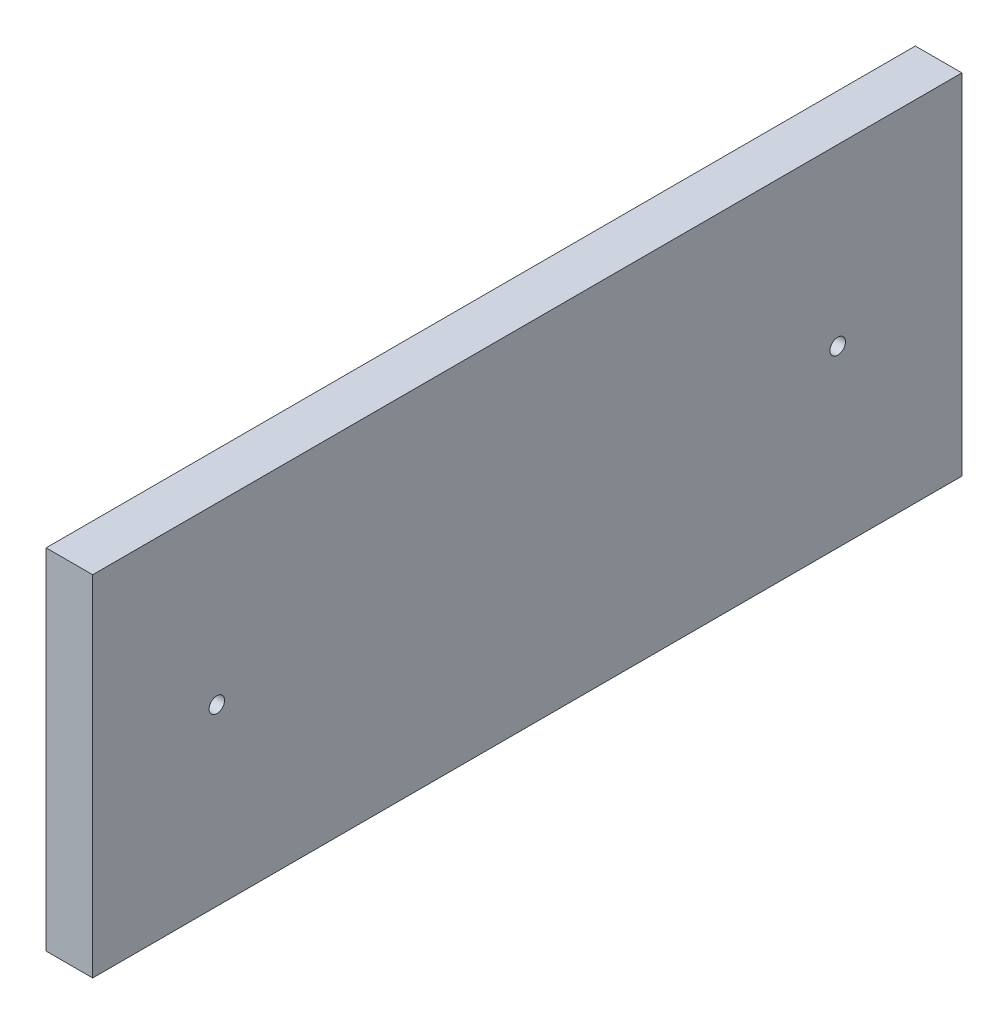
SolidWorks part; units mm, degrees
ref_plane "Front Plane" through (0, 0, 0) normal (0, 0, 1) x (1, 0, 0)
ref_plane "Top Plane" through (0, 0, 0) normal (0, 1, 0) x (1, 0, 0)
ref_plane "Right Plane" through (0, 0, 0) normal (1, 0, 0) x (0, 0, -1)
sketch "Sketch2" plane through (0, 0, 0) normal (0, 0, 1) x (1, 0, 0)
  line L1 (0, 0) -> (38.1, 0)
  line L2 (0, 0) -> (0, 285.75)
  line L3 (0, 285.75) -> (38.1, 285.75)
  line L4 (38.1, 0) -> (38.1, 285.75)
  line L5 (0, 0) -> (38.1, 285.75) construction
  line L6 (0, 285.75) -> (38.1, 0) construction
  point P4 (19.05, 142.875)
extrude "Boss-Extrude1" add sketch "Sketch2" along normal blind 711.2
sketch "Sketch3" plane through (38.1, 0, 0) normal (1, 0, 0) x (0, 0, -1)
  line L0 (-711.2, 142.875) -> (-609.6, 142.875) construction
  line L3 (-711.2, 0) -> (-711.2, 285.75) construction
  line L4 (-101.6, 142.875) -> (0, 142.875) construction
  line L5 (0, 0) -> (0, 285.75) construction
  circle A0 centre (-609.6, 142.875) radius 6.35
  circle A1 centre (-101.6, 142.875) radius 6.35
extrude "Cut-Extrude1" cut sketch "Sketch3" against normal through all
equation "\"system_width\"= 7ft + 10 "
equation "\"system_length\"= 95.5"
equation "\"module_board_length\"= 11.25in"
equation "\"module_board_width\"= 1.5in"
equation "\"module_width\"= (\"system_width\" -  2* \"module_trim_thickness\") / 2"
equation "\"module_length\"= (\"system_top_length\" - \"module_trim_thickness\")/ 2"
equation "\"module_board_long_depth\"= \"module_length\" - \"module_lip_width\""
equation "\"module_board_short_depth\"= \"module_width\" - ( 2 * \"module_board_width\" ) - \"module_lip_width\""
equation "\"D1@Sketch2\"=\"module_board_length\""
equation "\"D2@Sketch2\"=\"module_board_width\""
equation "\"D1@Boss-Extrude1\"=\"module_board_long_depth\""
equation "\"module_board_hole\"= 0.5in"
equation "\"D1@Sketch3\"=\"module_board_hole\""
equation "\"module_board_hole_position\"= ( ( \"module_width\" - \"module_board_hole_seperation\" ) / 2 ) + \"module_board_width\"/2"
equation "\"module_board_hole_seperation\"= 20in"
equation "\"D2@Sketch3\"=\"module_board_hole_seperation\""
equation "\"system_step_width\"= 3ft"
equation "\"system_top_length\"= \"system_length\" - \"system_step_length\""
equation "\"module_top_thickness\"= 0.75in"
equation "\"module_lip_width\"= 1.5in"
equation "\"module_trim_thickness\"= 1in"
equation "\"module_trim_height\"= 14in"
equation "\"module_top_overhang\"= 4.5in"
equation "\"module_trim_angle\"= 45deg"
equation "\"step_board_length\"= 5.5in"
equation "\"step_board_width\"= 1.5in"
equation "\"system_step_length\"= 2ft+11.5"
equation "\"step_module_width\"= \"module_width\""
equation "\"step_module_length\"= \"system_step_length\" - \"module_trim_thickness\""
equation "\"step_board_long_depth\"= \"step_module_width\" - (2 * \"module_board_width\") - \"module_lip_width\""
equation "\"step_board_short_depth\"= \"step_module_length\" - \"module_lip_width\""
equation "\"step_trim_height\"= 8in"
